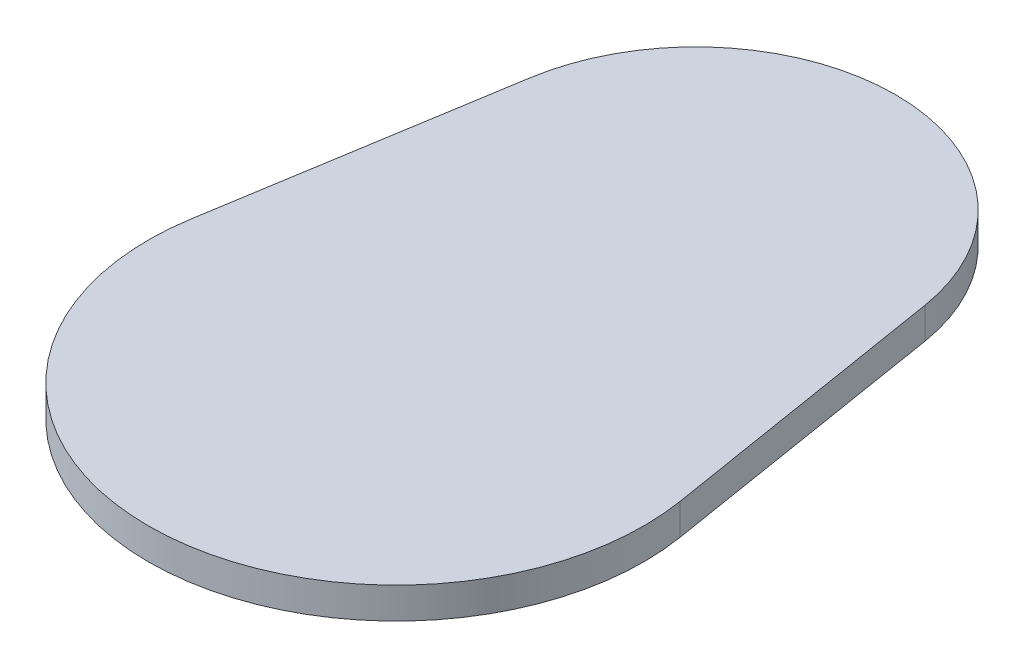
SolidWorks part; units mm, degrees
ref_plane "Front Plane" through (0, 0, 0) normal (0, 0, 1) x (1, 0, 0)
ref_plane "Top Plane" through (0, 0, 0) normal (0, 1, 0) x (1, 0, 0)
ref_plane "Right Plane" through (0, 0, 0) normal (1, 0, 0) x (0, 0, -1)
sketch "Sketch1" plane through (0, 0, 0) normal (0, 1, 0) x (1, 0, 0)
  line L0 (0, 0) -> (0, -19.05) construction
  line L1 (12.5364, 2.032) -> (15.5451, -16.5303)
  line L2 (-15.5451, -16.5303) -> (-12.5364, 2.032)
  arc A0 (-12.5364, 2.032) -> (12.5364, 2.032) centre (0, 0) cw
  arc A1 (15.5451, -16.5303) -> (-15.5451, -16.5303) centre (0, -19.05) cw
  dimension "D1" = 12.7
  dimension "D2" = 15.748
  dimension "D3" = 19.05
extrude "Extrude1" add sketch "Sketch1" along normal blind 1.9812
